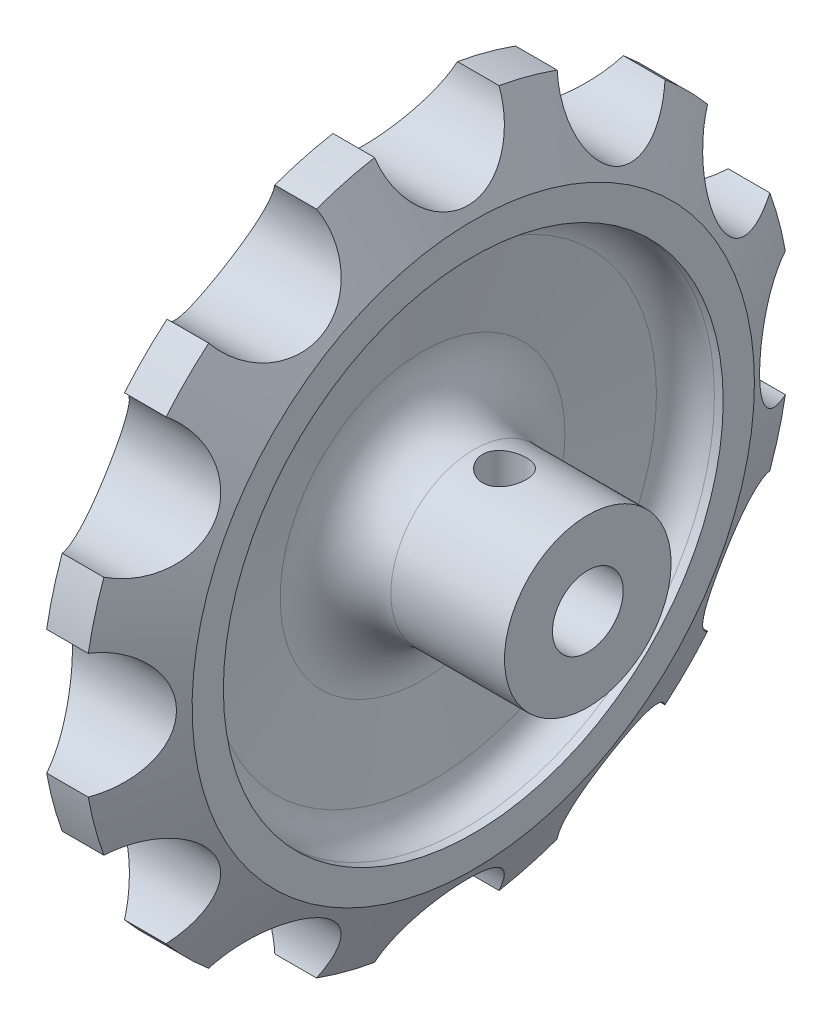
SolidWorks part; units mm, degrees
ref_plane "前视基准面" through (0, 0, 0) normal (0, 0, 1) x (1, 0, 0)
ref_plane "上视基准面" through (0, 0, 0) normal (0, 1, 0) x (1, 0, 0)
ref_plane "右视基准面" through (0, 0, 0) normal (1, 0, 0) x (0, 0, -1)
sketch "草图1" plane through (0, 0, 0) normal (0, 0, 1) x (1, 0, 0)
  line L0 (0, 0) -> (0, 13)
  line L1 (0, 13) -> (1, 13)
  line L2 (1, 13) -> (2.0356, 20.5947)
  line L3 (-0.9369, 24) -> (-1, 24)
  line L4 (-1, 24) -> (-1, 27)
  line L5 (-1, 27) -> (2.5, 34)
  line L6 (2.5, 34) -> (6.5, 34)
  line L7 (6.5, 34) -> (10, 27)
  line L8 (10, 27) -> (10, 24)
  line L9 (10, 24) -> (9.1557, 24)
  line L12 (21, 8) -> (21, 0)
  line L13 (21, 0) -> (0, 0)
  line L14 (21, 8) -> (10.0833, 8)
  line L15 (6.1832, 21.4053) -> (5.1291, 13.6756)
  arc A0 (5.1291, 13.6756) -> (10.0833, 8) centre (10.0833, 13) ccw
  arc A1 (6.1832, 21.4053) -> (9.1557, 24) centre (9.1557, 21) cw
  arc A2 (2.0356, 20.5947) -> (-0.9369, 24) centre (-0.9369, 21) ccw
  point P21 (2.5, 24)
  dimension "D1" = 5
  dimension "D3" = 3
  dimension "D2" = 8
revolve "旋转1" add sketch "草图1" angle 360 about L13
sketch "草图4" plane through (21, 0, 0) normal (1, 0, 0) x (0, 0, -1)
  point P0 (0, 0)
hole_wizard "M8 螺纹孔的螺纹孔钻头1" positions "3D草图2" profile "草图5" hole size "M8" standard "GB"
sketch3d "3D草图2"
  point P0 (0, 0, 0)
  point P3 (21, 0, 0)
sketch "草图5" plane through (21, 0, 0) normal (0, 1, 0) x (0, 0, -1)
  line L0 (0, 0) -> (0, 17.0429)
  line L1 (0, 17.0429) -> (3.4, 15)
  line L2 (3.4, 15) -> (3.4, 0)
  line L5 (3.4, 0) -> (0, 0)
  line L10 (0, 17.0429) -> (-3.4, 15) construction
  line L11 (0, -6.35) -> (0, 107.95) construction
  dimension "謂眻噤" = 6.8
  dimension "謂旮僅" = 15
  dimension "絳芛褒僅" = 118
ref_plane "基准面1" through (0, 8, 0) normal (0, 1, 0) x (-1, 0, 0)
sketch "草图12" plane through (0, 8, 0) normal (0, 1, 0) x (-1, 0, 0)
  circle A0 centre (-13, 0) radius 2
extrude "拉伸2" add sketch "草图12" against normal up to next
hole_wizard "M5 螺纹孔1" positions "3D草图7" profile "草图13" tap size "M5" standard "GB"
sketch3d "3D草图7"
  line L0 (13, 7.746, 0) -> (13, 8, 0) construction
  point P0 (13, 8, 0)
sketch "草图13" plane through (13, 8, 0) normal (1, 0, 0) x (0, 0, 1)
  line L0 (0, 0) -> (0, 4.6)
  line L1 (0, 4.6) -> (2.1, 4.6)
  line L2 (2.1, 4.6) -> (2.1, 0)
  line L5 (2.1, 0) -> (0, 0)
  line L11 (0, -6.35) -> (0, 107.95) construction
  dimension "籵謂蹟恇謂郰芛眻噤" = 4.2
  dimension "籵謂蹟恇謂郰芛旮僅" = 4.6
sketch "草图14" plane through (0, 0, 0) normal (1, 0, 0) x (0, 0, -1)
  circle A0 centre (0, -34) radius 6
  circle A1 centre (-17, -29.4449) radius 6
  circle A2 centre (-29.4449, -17) radius 6
  circle A3 centre (-34, 0) radius 6
  circle A4 centre (-29.4449, 17) radius 6
  circle A5 centre (-17, 29.4449) radius 6
  circle A6 centre (0, 34) radius 6
  circle A7 centre (17, 29.4449) radius 6
  circle A8 centre (29.4449, 17) radius 6
  circle A9 centre (34, 0) radius 6
  circle A10 centre (29.4449, -17) radius 6
  circle A11 centre (17, -29.4449) radius 6
extrude "切除-拉伸1" cut sketch "草图14" against normal up to next and the other way up to next
